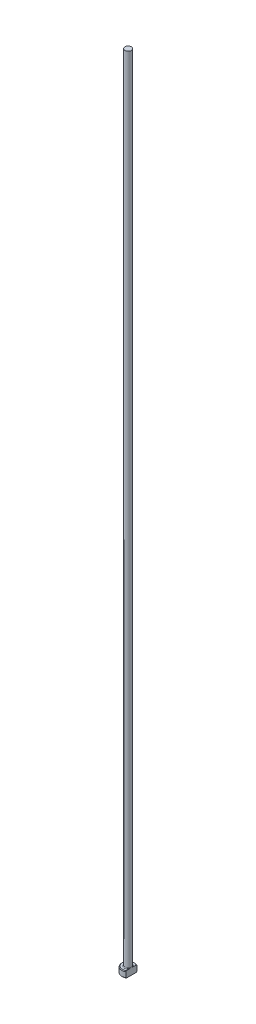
SolidWorks part; units mm, degrees
ref_plane "Front Plane" through (0, 0, 0) normal (0, 0, 1) x (1, 0, 0)
ref_plane "Top Plane" through (0, 0, 0) normal (0, 1, 0) x (1, 0, 0)
ref_plane "Right Plane" through (0, 0, 0) normal (1, 0, 0) x (0, 0, -1)
sketch "Sketch1" plane through (0, 0, 0) normal (0, 0, 1) x (1, 0, 0)
  line L0 (0, 259.9588) -> (0, -15.1925) construction
  line L1 (0, 0) -> (-2, 0)
  line L2 (-2, 0) -> (-2, 2)
  line L3 (-2, 2) -> (-1, 2)
  line L4 (-1, 2) -> (-1, 250)
  line L5 (-1, 250) -> (0, 250)
  line L6 (0, 250) -> (0, 0)
  dimension "L" = 250
  dimension "H" = 4
  dimension "T" = 2
  dimension "D" = 2
revolve "Revolve1" add sketch "Sketch1" angle 360 about L0
chamfer "Chamfer1" distance 0.2 angle 45 2 edges at (0, 2, 2) (0, 0, 2)
fillet "Fillet1" radius 0.2 1 edges at (0, 2, 1)
sketch "Sketch2" plane through (0, 0, 0) normal (0, 1, 0) x (1, 0, 0)
  line L0 (1, 1.7321) -> (1, -1.7321)
  circle A0 centre (0, 0) radius 2 construction
  arc A1 (1, -1.7321) -> (1, 1.7321) centre (0, 0) ccw
  circle A2 centre (0, 0) radius 1 construction
extrude "KEY" cut sketch "Sketch2" along normal through all
